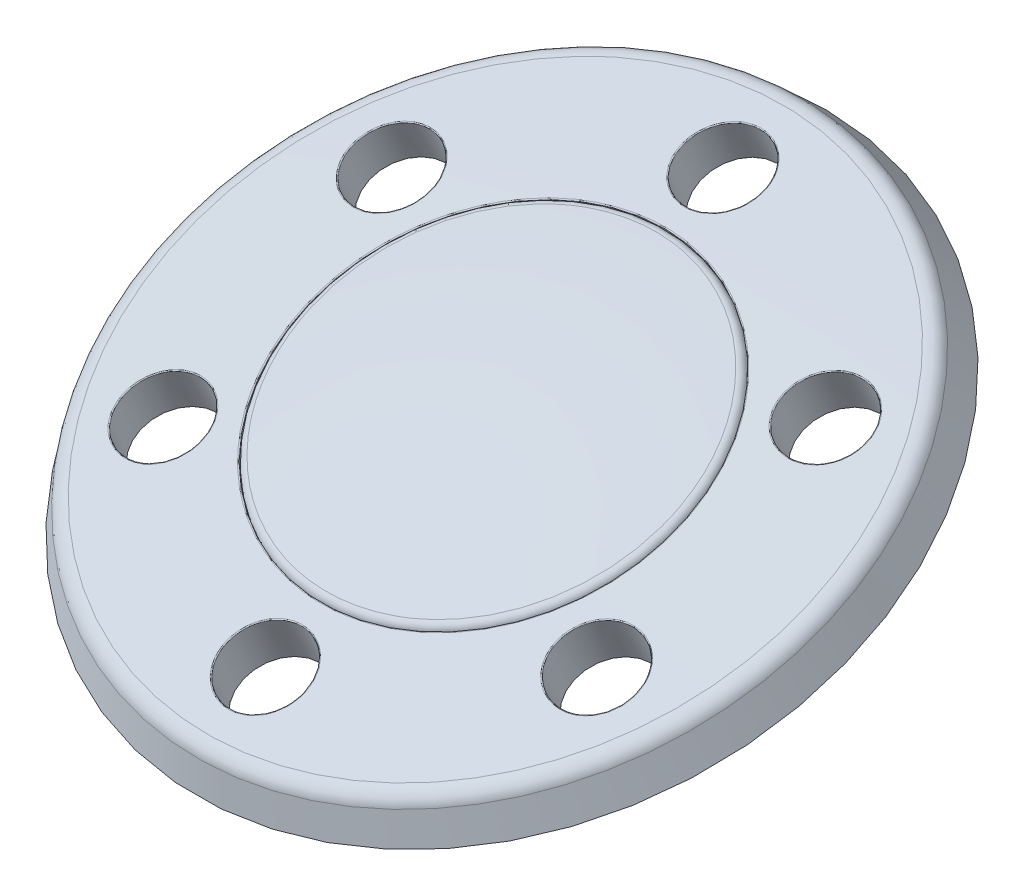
SolidWorks part; units mm, degrees
ref_plane "Plan de face" through (0, 0, 0) normal (0, 0, 1) x (1, 0, 0)
ref_plane "Plan de dessus" through (0, 0, 0) normal (0, 1, 0) x (1, 0, 0)
ref_plane "Plan de droite" through (0, 0, 0) normal (1, 0, 0) x (0, 0, -1)
imported_body "Importée9"
sketch "Esquisse2" plane through (0, 96.1094, 42.7907) normal (0, 0.9135, 0.4067) x (1, 0, 0)
  line L10 (-172.2232, -8.9402) -> (-172.2232, -194.2462)
  line L11 (-172.2232, -194.2462) -> (-64.0881, -216.2465)
  line L12 (64.0881, -216.2465) -> (172.2232, -194.2462)
  line L13 (172.2232, -194.2462) -> (172.2232, -8.9402)
  line L14 (62.2236, 109.8301) -> (-62.2236, 109.8302)
  line L15 (-172.2232, -8.9402) -> (-172.2232, -194.2462)
  line L16 (-172.2232, -194.2462) -> (-64.0881, -216.2465)
  line L17 (64.0881, -216.2465) -> (172.2232, -194.2462)
  line L18 (172.2232, -194.2462) -> (172.2232, -8.9402)
  line L19 (62.2236, 109.8301) -> (-62.2236, 109.8302)
  spline S16 degree 3 poles (2262.6796, 2005.8166) (1477.1629, 1365.2183) (689.0089, 722.4693) (-100.4636, 78.645) (-104.4195, 75.4189) (-106.3974, 73.8059) (-107.0576, 73.2693) (-108.374, 72.1912) (-109.0281, 71.6472) (-112.2785, 68.9026) (-114.8106, 66.6306) (-119.7253, 61.9479) (-122.11, 59.5354) (-126.7347, 54.5682) (-128.9754, 52.0125) (-133.3067, 46.7617) (-135.3896, 44.0761) (-137.8903, 40.6444) (-138.3853, 39.9543) (-139.365, 38.5667) (-139.8479, 37.8679) (-141.2976, 35.772) (-144.1969, 31.5802) (-723.6718, -806.225) (-1302.1803, -1642.6329) (-1878.7559, -2476.2463) knots -18.365962 -18.365962 -18.365962 -18.365962 0.25 0.3125 0.34375 0.34375 0.359375 0.359375 0.375 0.375 0.4375 0.4375 0.5 0.5 0.5625 0.5625 0.625 0.625 0.640625 0.640625 0.65625 0.65625 0.6875 0.75 19.393953 19.393953 19.393953 19.393953 only from (-62.2236, 109.8302) to (-172.2232, -8.9402)
  spline S17 degree 3 poles (-103.9254, 2747.6764) (-401.9268, 617.9456) (-319.3857, -141) (-43.3119, -223.2703) (-37.9939, -224.5799) (-31.2575, -225.8963) (-29.9058, -226.1436) (-27.1933, -226.6057) (-25.8311, -226.8207) (-21.7478, -227.4146) (-19.0265, -227.743) (-10.8654, -228.5295) (-5.4282, -228.7891) (5.4391, -228.7888) (10.8691, -228.5288) (19.0089, -227.7449) (21.7213, -227.4179) (25.7884, -226.8272) (27.1439, -226.6136) (29.8545, -226.1527) (31.2109, -225.9051) (37.9657, -224.5868) (43.2944, -223.2752) (326.3319, -138.9497) (396.3569, 654.4876) (86.5889, 2747.0815) knots -6.326441 -6.326441 -6.326441 -6.326441 0.125 0.125 0.25 0.25 0.28125 0.28125 0.3125 0.3125 0.375 0.375 0.5 0.5 0.625 0.625 0.6875 0.6875 0.71875 0.71875 0.75 0.75 0.875 0.875 7.48324 7.48324 7.48324 7.48324 only from (-64.0881, -216.2465) to (64.0881, -216.2465)
  spline S18 degree 3 poles (1878.7415, -2476.2254) (1302.1647, -1642.6104) (723.6537, -806.1988) (144.1755, 31.6111) (141.274, 35.8061) (139.8233, 37.9036) (139.3397, 38.6028) (138.3588, 39.9914) (137.8631, 40.6821) (136.3603, 42.7431) (135.3374, 44.1026) (133.2546, 46.7863) (132.194, 48.1112) (128.9553, 52.0355) (126.7201, 54.5844) (122.0979, 59.5479) (119.7101, 61.9632) (114.784, 66.6552) (112.2534, 68.9246) (109.006, 71.6657) (108.3523, 72.2091) (107.0365, 73.2865) (106.3766, 73.8229) (104.3996, 75.4351) (100.4456, 78.6597) (-689.0174, 722.4763) (-1477.1624, 1365.218) (-2262.6715, 2005.81) knots -18.379791 -18.379791 -18.379791 -18.379791 0.25 0.3125 0.34375 0.34375 0.359375 0.359375 0.375 0.375 0.40625 0.40625 0.4375 0.4375 0.5 0.5 0.5625 0.5625 0.625 0.625 0.640625 0.640625 0.65625 0.65625 0.6875 0.75 19.374566 19.374566 19.374566 19.374566 only from (172.2232, -8.9402) to (62.2236, 109.8301)
  spline S19 degree 3 poles (-62.2236, 109.8302) (-72.7726, 101.2273) (-85.9588, 90.4738) (-100.4636, 78.645) (-104.4195, 75.4189) (-106.3974, 73.8059) (-107.0576, 73.2693) (-108.374, 72.1912) (-109.0281, 71.6472) (-112.2785, 68.9026) (-114.8106, 66.6306) (-119.7253, 61.9479) (-122.11, 59.5354) (-126.7347, 54.5682) (-128.9754, 52.0125) (-133.3067, 46.7617) (-135.3896, 44.0761) (-137.8903, 40.6444) (-138.3853, 39.9543) (-139.365, 38.5667) (-139.8479, 37.8679) (-141.2976, 35.772) (-144.1969, 31.5802) (-154.8275, 16.2104) (-164.4918, 2.2378) (-172.2232, -8.9402) knots 0 0 0 0 0.25 0.3125 0.34375 0.34375 0.359375 0.359375 0.375 0.375 0.4375 0.4375 0.5 0.5 0.5625 0.5625 0.625 0.625 0.640625 0.640625 0.65625 0.65625 0.6875 0.75 1 1 1 1
  spline S20 degree 3 poles (-64.0881, -216.2465) (-58.9834, -218.3245) (-53.8067, -220.1429) (-43.3119, -223.2703) (-37.9939, -224.5799) (-31.2575, -225.8963) (-29.9058, -226.1436) (-27.1933, -226.6057) (-25.8311, -226.8207) (-21.7478, -227.4146) (-19.0265, -227.743) (-10.8654, -228.5295) (-5.4282, -228.7891) (5.4391, -228.7888) (10.8691, -228.5288) (19.0089, -227.7449) (21.7213, -227.4179) (25.7884, -226.8272) (27.1439, -226.6136) (29.8545, -226.1527) (31.2109, -225.9051) (37.9657, -224.5868) (43.2944, -223.2752) (53.8033, -220.1443) (58.9835, -218.3245) (64.0881, -216.2465) knots 0 0 0 0 0.125 0.125 0.25 0.25 0.28125 0.28125 0.3125 0.3125 0.375 0.375 0.5 0.5 0.625 0.625 0.6875 0.6875 0.71875 0.71875 0.75 0.75 0.875 0.875 1 1 1 1
  spline S21 degree 3 poles (172.2232, -8.9402) (164.4859, 2.2463) (154.8143, 16.2296) (144.1755, 31.6111) (141.274, 35.8061) (139.8233, 37.9036) (139.3397, 38.6028) (138.3588, 39.9914) (137.8631, 40.6821) (136.3603, 42.7431) (135.3374, 44.1026) (133.2546, 46.7863) (132.194, 48.1112) (128.9553, 52.0355) (126.7201, 54.5844) (122.0979, 59.5479) (119.7101, 61.9632) (114.784, 66.6552) (112.2534, 68.9246) (109.006, 71.6657) (108.3523, 72.2091) (107.0365, 73.2865) (106.3766, 73.8229) (104.3996, 75.4351) (100.4456, 78.6597) (85.9476, 90.483) (72.7676, 101.2314) (62.2236, 109.8301) knots 0 0 0 0 0.25 0.3125 0.34375 0.34375 0.359375 0.359375 0.375 0.375 0.40625 0.40625 0.4375 0.4375 0.5 0.5 0.5625 0.5625 0.625 0.625 0.640625 0.640625 0.65625 0.65625 0.6875 0.75 1 1 1 1
  dimension "D1" = 130
extrude "Enlèv. mat.-Extru.3" cut sketch "Esquisse2" against normal blind 90
